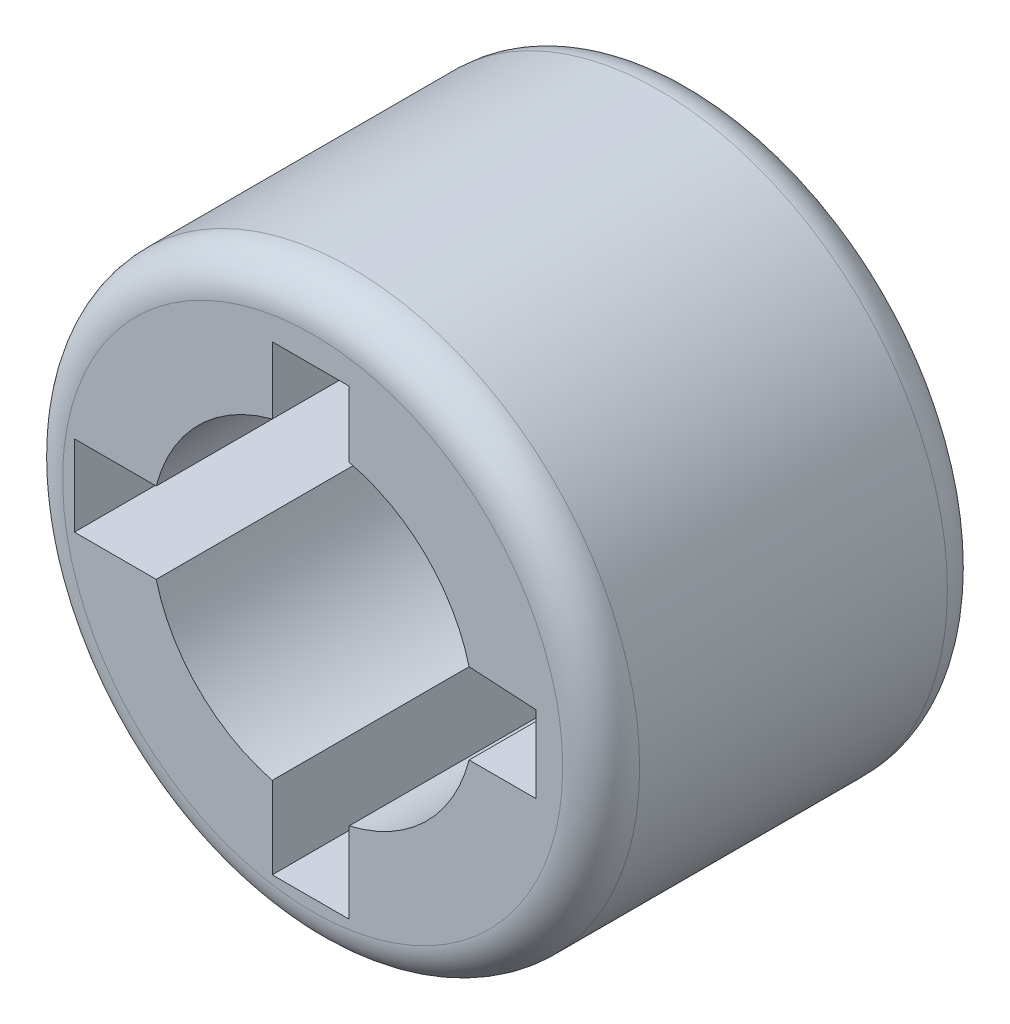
SolidWorks part; units mm, degrees
ref_plane "Front Plane" through (0, 0, 0) normal (0, 0, 1) x (1, 0, 0)
ref_plane "Top Plane" through (0, 0, 0) normal (0, 1, 0) x (1, 0, 0)
ref_plane "Right Plane" through (0, 0, 0) normal (1, 0, 0) x (0, 0, -1)
sketch "Sketch1" plane through (0, 0, 0) normal (0, 0, 1) x (1, 0, 0)
  line L1 (-6.1932, -1.05) -> (-4.0666, -1.05)
  line L2 (-6.1932, -1.05) -> (-6.1932, 1.05)
  line L3 (-6.1932, 1.05) -> (-4.0666, 1.05)
  line L4 (5.8064, -1.05) -> (5.8064, 0.95)
  line L7 (-1.05, -6.1936) -> (0.95, -6.1936)
  line L8 (-1.05, -6.1936) -> (-1.05, -4.0666)
  line L9 (-1.05, 5.8064) -> (0.95, 5.8064)
  line L10 (0.95, -6.1936) -> (0.95, -4.0911)
  line L14 (-1.05, 4.0666) -> (-1.05, 5.8064)
  line L16 (0.95, 4.0911) -> (0.95, 5.8064)
  line L17 (4.0666, 1.05) -> (5.8064, 0.95)
  line L20 (4.0666, -1.05) -> (5.8064, -1.05)
  arc A0 (-4.0666, -1.05) -> (-1.05, -4.0666) centre (0, 0) ccw
  circle A1 centre (0, 0) radius 7.5
  arc A2 (-1.05, 4.0666) -> (-4.0666, 1.05) centre (0, 0) ccw
  arc A3 (4.0666, 1.05) -> (0.95, 4.0911) centre (0, 0) ccw
  arc A4 (0.95, -4.0911) -> (4.0666, -1.05) centre (0, 0) ccw
  point P16 (0, 0)
  dimension "D1" = 8.4
  dimension "D2" = 15
  dimension "D3" = 12
  dimension "D4" = 12
  dimension "D5" = 2
  dimension "D6" = 2
extrude "Boss-Extrude1" add sketch "Sketch1" along normal blind 10
fillet "Fillet1" radius 1 2 edges at (7.5, 0, 0) (7.5, 0, 10)
